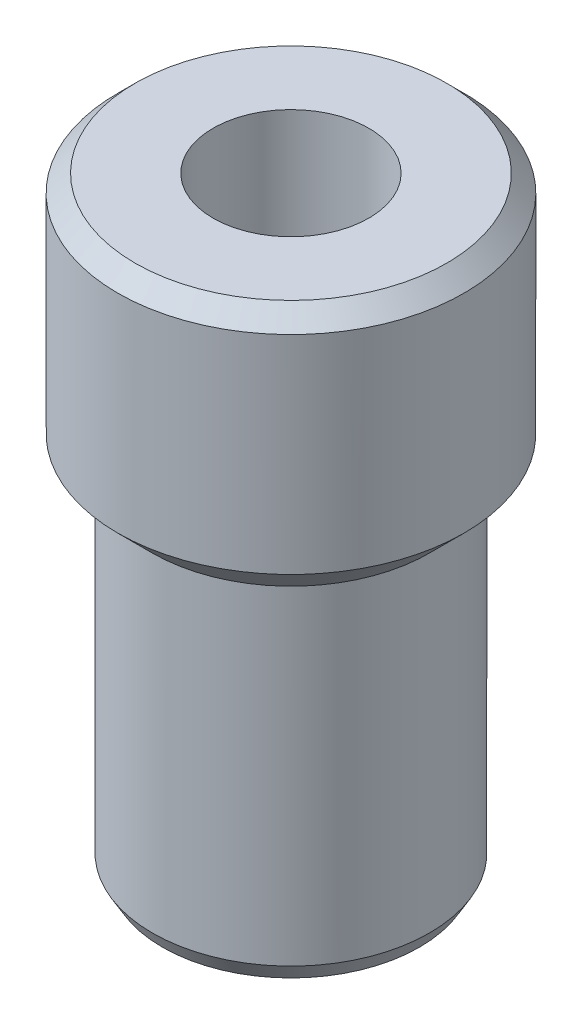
SolidWorks part; units mm, degrees
ref_plane "Plan1" through (0, 0, 0) normal (0, 0, 1) x (1, 0, 0)
ref_plane "Plan2" through (0, 0, 0) normal (0, 1, 0) x (1, 0, 0)
ref_plane "Plan3" through (0, 0, 0) normal (1, 0, 0) x (0, 0, -1)
sketch "Esquisse1" plane through (0, 0, 0) normal (0, 0, 1) x (1, 0, 0)
  line L0 (0, 25.7125) -> (0, -24.225) construction
  line L1 (4.5, 15) -> (10, 15)
  line L2 (10, 15) -> (10, 0)
  line L3 (10, 0) -> (8, 0)
  line L4 (8, 0) -> (8, -20)
  line L5 (8, -20) -> (4.5, -20)
  line L6 (4.5, -20) -> (4.5, 15)
  dimension "D1" = 4.5
  dimension "D2" = 15
  dimension "D3" = 20
  dimension "D4" = 8
  dimension "D5" = 10
revolve "Base-Révolution" add sketch "Esquisse1" angle 360 about L0
chamfer "Chanfrein1" distance 1 angle 45
chamfer "Chanfrein2" distance 1 angle 30
chamfer "Chanfrein3" distance 2 angle 45
